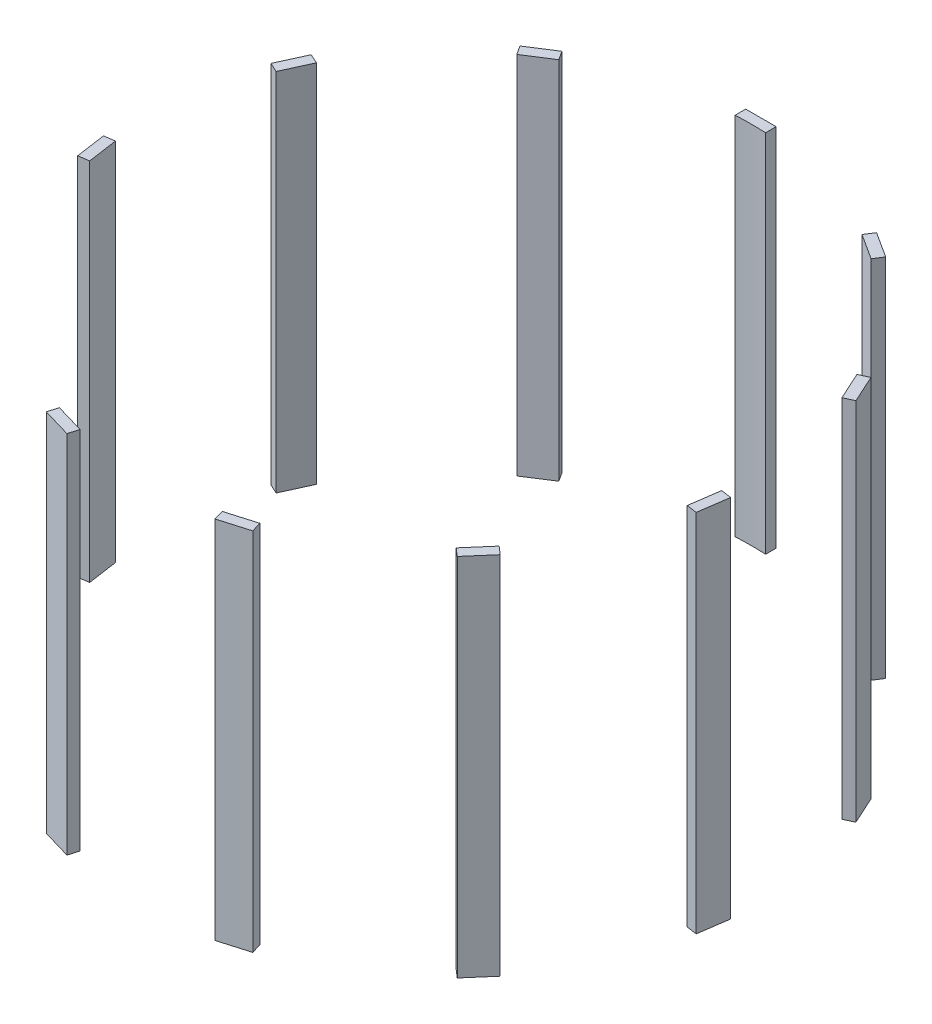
SolidWorks part; units mm, degrees
ref_plane "Front Plane" through (0, 0, 0) normal (0, 0, 1) x (1, 0, 0)
ref_plane "Top Plane" through (0, 0, 0) normal (0, 1, 0) x (1, 0, 0)
ref_plane "Right Plane" through (0, 0, 0) normal (1, 0, 0) x (0, 0, -1)
sketch "Sketch2" plane through (0, 0, 0) normal (0, 1, 0) x (1, 0, 0)
  line L4 (0, 95.25) -> (4.699, 95.134)
  line L5 (4.699, 95.134) -> (4.699, 98.436)
  line L6 (4.699, 98.436) -> (-4.826, 98.436)
  line L7 (-4.826, 98.436) -> (-4.826, 95.1277)
  line L8 (-4.826, 95.1277) -> (0, 95.25)
  line L11 (55.3864, 77.4914) -> (57.1716, 80.2692)
  line L12 (57.1716, 80.2692) -> (49.1586, 85.4188)
  line L13 (49.1586, 85.4188) -> (47.37, 82.6356)
  line L16 (88.489, 35.2457) -> (91.4926, 36.6174)
  line L17 (91.4926, 36.6174) -> (87.5358, 45.2817)
  line L18 (87.5358, 45.2817) -> (84.5264, 43.9073)
  line L21 (93.497, -18.1902) -> (96.7653, -18.6601)
  line L22 (96.7653, -18.6601) -> (98.1209, -9.232)
  line L23 (98.1209, -9.232) -> (94.8462, -8.7612)
  line L26 (68.8203, -65.8508) -> (71.3158, -68.0132)
  line L27 (71.3158, -68.0132) -> (77.5533, -60.8146)
  line L28 (77.5533, -60.8146) -> (75.053, -58.6481)
  line L31 (22.2937, -92.6043) -> (23.224, -95.7725)
  line L32 (23.224, -95.7725) -> (32.3631, -93.089)
  line L33 (32.3631, -93.089) -> (31.4311, -89.9147)
  line L36 (-31.311, -89.9566) -> (-32.2413, -93.1248)
  line L37 (-32.2413, -93.1248) -> (-23.1021, -95.8083)
  line L38 (-23.1021, -95.8083) -> (-22.17, -92.634)
  line L41 (-74.9747, -58.7483) -> (-77.4702, -60.9106)
  line L42 (-77.4702, -60.9106) -> (-71.2326, -68.1091)
  line L43 (-71.2326, -68.1091) -> (-68.7323, -65.9426)
  line L46 (-94.8344, -8.8878) -> (-98.1028, -9.3577)
  line L47 (-98.1028, -9.3577) -> (-96.7473, -18.7858)
  line L48 (-96.7473, -18.7858) -> (-93.4726, -18.315)
  line L51 (-84.5849, 43.7945) -> (-87.5885, 45.1662)
  line L52 (-87.5885, 45.1662) -> (-91.5453, 36.5019)
  line L53 (-91.5453, 36.5019) -> (-88.536, 35.1276)
  line L54 (-93.4726, -18.315) -> (-94.8344, -8.8878)
  line L55 (-93.4726, -18.315) -> (-94.2805, -13.5555)
  line L56 (-94.2805, -13.5555) -> (-94.8344, -8.8878)
  line L57 (-88.536, 35.1276) -> (-84.5849, 43.7945)
  line L58 (-88.536, 35.1276) -> (-86.6424, 39.5683)
  line L59 (-86.6424, 39.5683) -> (-84.5849, 43.7945)
  line L60 (-55.4898, 77.4173) -> (-47.4803, 82.5723)
  line L61 (-71.9851, -62.3755) -> (-74.9747, -58.7483)
  line L62 (-68.7323, -65.9426) -> (-71.9851, -62.3755)
  line L63 (47.37, 82.6356) -> (55.3864, 77.4914)
  line L64 (47.37, 82.6356) -> (51.496, 80.1294)
  line L65 (51.496, 80.1294) -> (55.3864, 77.4914)
  line L66 (84.5264, 43.9073) -> (88.489, 35.2457)
  line L67 (84.5264, 43.9073) -> (86.6424, 39.5683)
  line L68 (86.6424, 39.5683) -> (88.489, 35.2457)
  line L69 (94.8462, -8.7612) -> (93.497, -18.1902)
  line L70 (94.8462, -8.7612) -> (94.2805, -13.5555)
  line L71 (94.2805, -13.5555) -> (93.497, -18.1902)
  line L72 (68.8203, -65.8508) -> (75.053, -58.6481)
  line L73 (75.053, -58.6481) -> (71.9851, -62.3755)
  line L74 (71.9851, -62.3755) -> (68.8203, -65.8508)
  line L75 (22.2937, -92.6043) -> (31.4311, -89.9147)
  line L76 (31.4311, -89.9147) -> (26.835, -91.3917)
  line L77 (26.835, -91.3917) -> (22.2937, -92.6043)
  line L78 (-31.311, -89.9566) -> (-22.17, -92.634)
  line L79 (-26.835, -91.3917) -> (-31.311, -89.9566)
  line L80 (-22.17, -92.634) -> (-26.835, -91.3917)
  line L81 (-74.9747, -58.7483) -> (-77.4702, -60.9106)
  line L85 (-47.4803, 82.5723) -> (-49.2655, 85.3501)
  line L86 (-49.2655, 85.3501) -> (-57.2784, 80.2005)
  line L87 (-57.2784, 80.2005) -> (-55.4898, 77.4173)
  line L88 (-55.4898, 77.4173) -> (-51.496, 80.1294)
  line L89 (-51.496, 80.1294) -> (-47.4803, 82.5723)
  circle A0 centre (0, 0) radius 95.25
  point P56 (0, 0)
  dimension "D1" = 190.5
  dimension "D2" = 9.525
  dimension "D3" = 4.826
  dimension "D4" = 3.302
  dimension "D5" = 11
extrude "Boss-Extrude1" add sketch "Sketch2" along normal blind 114.3 contours A0 L5 L6 L7
